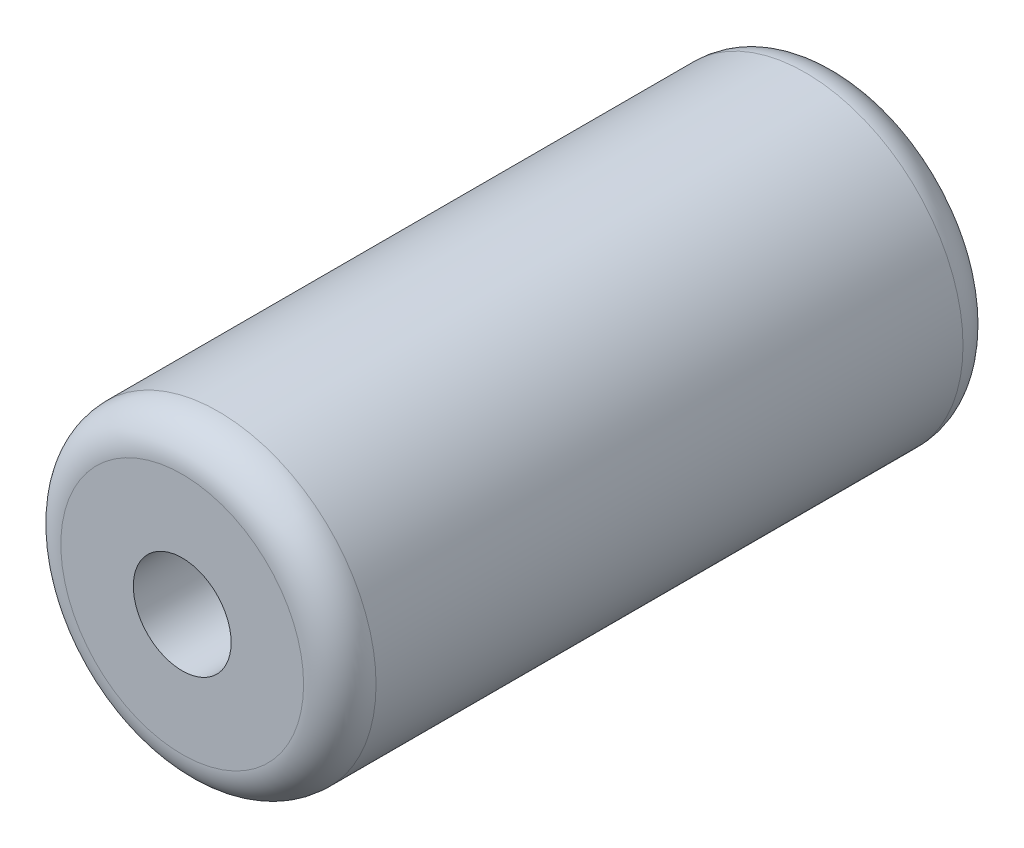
SolidWorks part; units mm, degrees
ref_plane "Plan de face" through (0, 0, 0) normal (0, 0, 1) x (1, 0, 0)
ref_plane "Plan de dessus" through (0, 0, 0) normal (0, 1, 0) x (1, 0, 0)
ref_plane "Plan de droite" through (0, 0, 0) normal (1, 0, 0) x (0, 0, -1)
sketch "Esquisse1" plane through (0, 0, 0) normal (0, 0, 1) x (1, 0, 0)
  circle A0 centre (0, 0) radius 43.5
  dimension "D1" = 87
extrude "Extrusion1" add sketch "Esquisse1" along normal blind 182
fillet "Congé1" radius 10 2 edges at (43.5, 0, 0) (43.5, 0, 182)
sketch "Esquisse2" plane through (0, 0, 182) normal (0, 0, 1) x (1, 0, 0)
  circle A0 centre (0, 0) radius 13.5
  dimension "D1" = 27
extrude "Enlèv. mat.-Extru.1" cut sketch "Esquisse2" against normal through all
